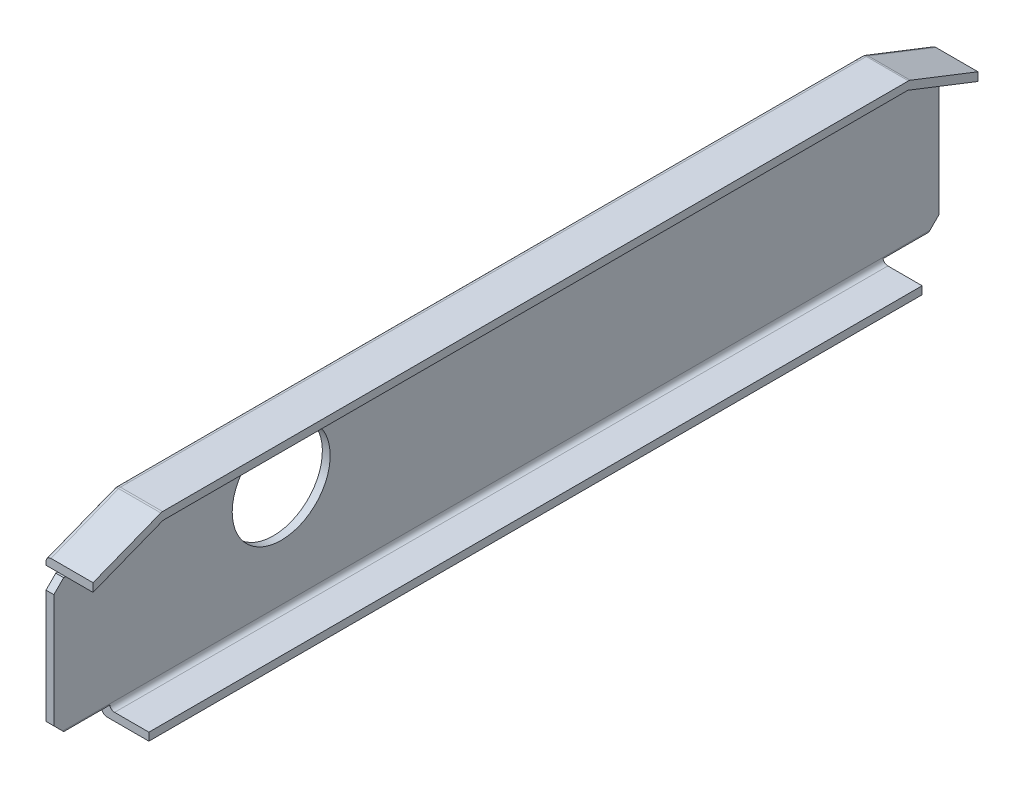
SolidWorks part; units mm, degrees
ref_plane "前视基准面" through (0, 0, 0) normal (0, 0, 1) x (1, 0, 0)
ref_plane "上视基准面" through (0, 0, 0) normal (0, 1, 0) x (1, 0, 0)
ref_plane "右视基准面" through (0, 0, 0) normal (1, 0, 0) x (0, 0, -1)
sketch "草图1" plane through (0, 0, 0) normal (0, 0, 1) x (1, 0, 0)
  line L0 (48, -8) -> (48, 0)
  line L1 (48, 0) -> (0, 0)
  line L2 (0, 0) -> (0, -196)
  line L3 (0, -196) -> (48, -196)
  line L4 (48, -196) -> (48, -188)
  line L5 (48, -188) -> (8, -188)
  line L6 (8, -188) -> (8, -8)
  line L7 (8, -8) -> (48, -8)
  dimension "D1" = 196
  dimension "D2" = 8
  dimension "D3" = 8
  dimension "D4" = 48
  dimension "D5" = 48
  dimension "D6" = 8
extrude "拉伸1" add sketch "草图1" along normal blind 903
sketch "草图2" plane through (0, 0, 0) normal (-1, 0, 0) x (0, 0, 1)
  line L0 (903, 0) -> (903, -196) construction
  line L1 (903, 0) -> (0, 0) construction
  circle A0 centre (671, -76) radius 50
  dimension "D1" = 232
  dimension "D2" = 76
  dimension "D3" = 100
extrude "切除-拉伸1" cut sketch "草图2" against normal through all
fillet "圆角1" radius 5 4 edges at (0, -196, 451.5) (8, -188, 451.5) (8, -8, 451.5) (0, 0, 451.5)
sketch "草图3" plane through (0, 0, 0) normal (-1, 0, 0) x (0, 0, 1)
  line L0 (903, -5) -> (903, -191) construction
  line L1 (903, -36) -> (846, -36)
  line L2 (903, -36) -> (903, -48)
  line L3 (903, -48) -> (846, -48)
  line L4 (846, -36) -> (846, -48)
  line L5 (0, -5) -> (0, -191) construction
  line L6 (0, -36) -> (57, -36)
  line L7 (0, -36) -> (0, -48)
  line L8 (0, -48) -> (57, -48)
  line L9 (57, -36) -> (57, -48)
  line L10 (0, 0) -> (903, 0) construction
  dimension "D1" = 57
  dimension "D2" = 12
  dimension "D3" = 36
  dimension "D4" = 12
  dimension "D5" = 57
  dimension "D6" = 36
extrude "切除-拉伸2" cut sketch "草图3" against normal blind 10
chamfer "倒角1" distance 10 angle 45 2 edges at (4, -48, 0) (4, -48, 903)
sketch "草图4" plane through (0, 0, 0) normal (-1, 0, 0) x (0, 0, 1)
  line L0 (903, -196) -> (0, -196) construction
  line L1 (1113.3655, -184) -> (846, -184)
  line L2 (1113.3655, -184) -> (1113.3655, -345.0277)
  line L3 (1113.3655, -345.0277) -> (846, -345.0277)
  line L4 (846, -184) -> (846, -345.0277)
  line L5 (-33.0086, -184) -> (57, -184)
  line L6 (-33.0086, -184) -> (-33.0086, -295.4571)
  line L7 (-33.0086, -295.4571) -> (57, -295.4571)
  line L8 (57, -184) -> (57, -295.4571)
  line L9 (0, -58) -> (0, -191) construction
  line L11 (903, -58) -> (903, -191) construction
  dimension "D1" = 12
  dimension "D2" = 57
  dimension "D3" = 12
  dimension "D4" = 57
extrude "切除-拉伸3" cut sketch "草图4" against normal through all
chamfer "倒角2" distance 10 angle 45 2 edges at (4.0505, -184, 903) (4.0505, -184, 0)
sketch "草图6" plane through (48, 0, 0) normal (1, 0, 0) x (0, 0, -1)
  line L0 (-903, -36) -> (-811.0581, 0)
  line L1 (-903, 0) -> (0, 0) construction
  line L2 (-811.0581, 0) -> (-833, 0)
  line L3 (-833, 0) -> (-903, -27.4086)
  line L4 (-903, -36) -> (-903, -13) construction
  line L5 (-903, -27.4086) -> (-903, -36)
  dimension "D1" = 8
  dimension "D2" = 70
extrude "拉伸2" add sketch "草图6" against normal up to surface (48 mm away)
sketch "草图7" plane through (48, 0, 0) normal (1, 0, 0) x (0, 0, -1)
  line L0 (-903, -27.4086) -> (-903, 0)
  line L1 (-903, -27.4086) -> (-833, 0)
  line L2 (-833, 0) -> (-903, 0)
extrude "拉伸3" cut sketch "草图7" against normal through all
sketch "草图8" plane through (0, 275.3556, 107.8159) normal (0, -0.9312, -0.3646) x (1, 0, 0)
  line L2 (0, 755.2286) -> (5, 755.2286)
  line L3 (0, 768.9423) -> (0, 755.2286)
  line L4 (0, 755.2286) -> (5, 755.2286)
  line L5 (0, 768.9423) -> (0, 755.2286)
  ellipse E1 centre (5, 768.9423) end of major axis (5, 755.2286) minor radius 5 (0, 768.9423) -> (5, 755.2286) ccw
  ellipse E2 centre (5, 768.9423) end of major axis (5, 755.2286) minor radius 5 (0, 768.9423) -> (5, 755.2286) ccw
  dimension "D1" = 0
extrude "拉伸4" cut sketch "草图8" against normal through all
fillet "圆角2" radius 5 1 edges at (0, 0, 829.3928)
fillet "圆角3" radius 5 3 edges at (0, -16.2043, 874.3849) (1.4645, -1.4645, 836.7402) (26.5, 0, 833)
sketch "草图9" plane through (48, 0, 0) normal (1, 0, 0) x (0, 0, -1)
  line L0 (0, -36) -> (-91.9419, 0)
  line L1 (-832.056, 0) -> (0, 0) construction
  line L2 (-91.9419, 0) -> (-70, 0)
  line L3 (-70, 0) -> (0, -27.4086)
  line L4 (0, -36) -> (0, -13) construction
  line L5 (0, -27.4086) -> (0, -36)
  line L6 (0, -8) -> (0, 0) construction
  dimension "D1" = 8
  dimension "D2" = 70
extrude "拉伸5" add sketch "草图9" against normal up to surface (48 mm away)
sketch "草图10" plane through (48, 0, 0) normal (1, 0, 0) x (0, 0, -1)
  line L0 (0, -27.4086) -> (-70, 0)
  line L1 (-70, 0) -> (0, 0)
  line L2 (0, 0) -> (0, -27.4086)
extrude "拉伸6" cut sketch "草图10" against normal through all
sketch "草图11" plane through (0, -31.2144, 12.2221) normal (0, -0.9312, 0.3646) x (1, 0, 0)
  line L2 (0, 85.6131) -> (0, 71.8994)
  line L3 (5, 85.6131) -> (0, 85.6131)
  line L4 (0, 85.6131) -> (0, 71.8994)
  line L5 (5, 85.6131) -> (0, 85.6131)
  ellipse E1 centre (5, 71.8994) end of major axis (5, 58.1857) minor radius 5 (5, 85.6131) -> (0, 71.8994) ccw
  ellipse E2 centre (5, 71.8994) end of major axis (5, 58.1857) minor radius 5 (5, 85.6131) -> (0, 71.8994) ccw
  dimension "D1" = 0
extrude "拉伸7" cut sketch "草图11" against normal through all
fillet "圆角4" radius 5 1 edges at (0, 0, 73.6072)
fillet "圆角5" radius 5 6 edges at (0, -16.2043, 28.6151) (1.4645, -1.4645, 66.2598) (26.5, 0, 70) (30.5, -8, 831.4896) (9.4645, -9.4645, 835.2298) (8, -24.5, 873.6297)
fillet "圆角6" radius 5 3 edges at (30.5, -8, 71.5104) (9.4645, -9.4645, 67.7702) (8, -24.5, 29.3703)
